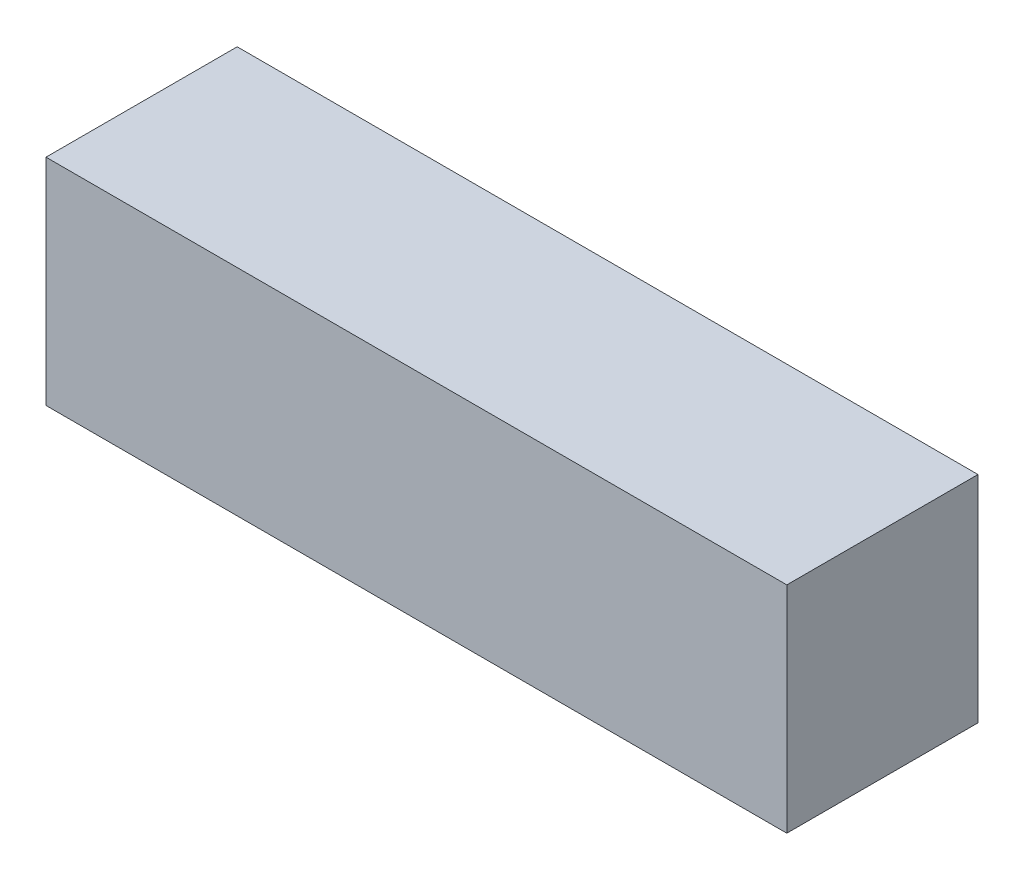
SolidWorks part; units mm, degrees
ref_plane "Plan de face" through (0, 0, 0) normal (0, 0, 1) x (1, 0, 0)
ref_plane "Plan de dessus" through (0, 0, 0) normal (0, 1, 0) x (1, 0, 0)
ref_plane "Plan de droite" through (0, 0, 0) normal (1, 0, 0) x (0, 0, -1)
sketch "Esquisse1" plane through (0, 0, 0) normal (0, 0, 1) x (1, 0, 0)
  line L1 (0, 0) -> (31, 0)
  line L2 (0, 0) -> (0, 9)
  line L3 (0, 9) -> (31, 9)
  line L4 (31, 0) -> (31, 9)
  dimension "D1" = 31
  dimension "D2" = 9
extrude "Extrusion1" add sketch "Esquisse1" along normal blind 8
